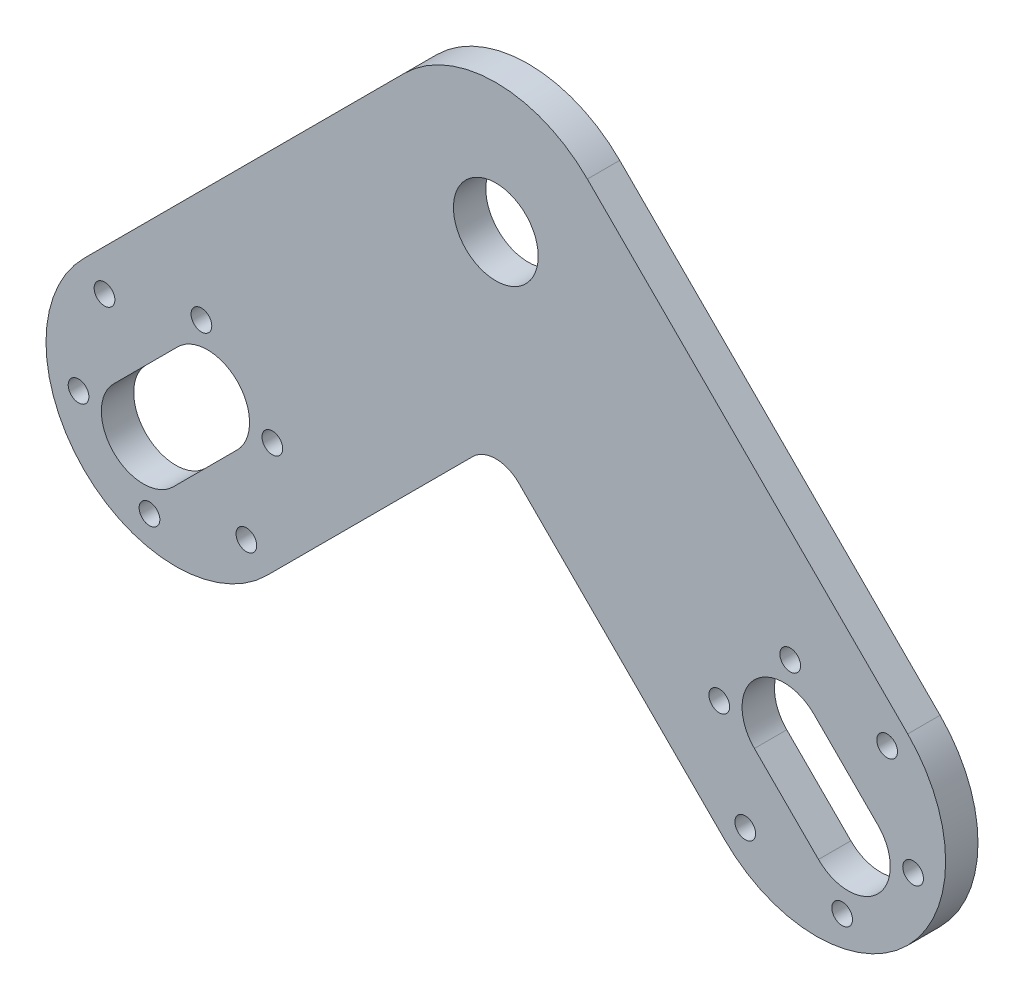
SolidWorks part; units mm, degrees
ref_plane "前视基准面" through (0, 0, 0) normal (0, 0, 1) x (1, 0, 0)
ref_plane "上视基准面" through (0, 0, 0) normal (0, 1, 0) x (1, 0, 0)
ref_plane "右视基准面" through (0, 0, 0) normal (1, 0, 0) x (0, 0, -1)
other "Configuration Table"
sketch "草图1" plane through (0, 0, 0) normal (0, 0, 1) x (1, 0, 0)
  line L0 (0, 0) -> (49.4975, 49.4975)
  line L1 (-14.1421, 14.1421) -> (35.3553, 63.6396)
  line L2 (14.1421, -14.1421) -> (49.4975, 21.2132)
  line L3 (49.4975, 49.4975) -> (49.4975, 29.4975) construction
  line L4 (84.8528, -14.1421) -> (49.4975, 21.2132)
  line L5 (113.1371, 14.1421) -> (63.6396, 63.6396)
  line L6 (98.9949, 0) -> (49.4975, 49.4975)
  line L7 (49.4975, 21.2132) -> (35.3553, 35.3553) construction
  line L8 (49.4975, 29.4975) -> (49.4975, 21.2132) construction
  line L9 (49.4975, 21.2132) -> (49.4975, -18.5446) construction
  line L10 (49.4975, 21.2132) -> (63.6396, 35.3553) construction
  circle A3 centre (0, 0) radius 20
  circle A4 centre (49.4975, 49.4975) radius 20
  circle A5 centre (98.9949, 0) radius 20
  dimension "D1" = 40
  dimension "D2" = 40
  dimension "D3" = 45
  dimension "D4" = 70
extrude "凸台-拉伸1" add sketch "草图1" along normal blind 5
fillet "圆角1" radius 5 1 edges at (49.4975, 21.2132, 2.5)
sketch "草图2" plane through (0, 0, 0) normal (0, 0, -1) x (-1, 0, 0)
  line L0 (-49.4975, 19.1421) -> (-49.4975, 0.3536)
  line L1 (-108.5409, -0.3536) -> (-98.6414, 9.5459)
  line L2 (-9.5459, 0.3536) -> (0.3536, -9.5459)
  line L3 (9.5459, -0.3536) -> (-0.3536, 9.5459)
  line L4 (-9.5459, 0.3536) -> (0.3536, -9.5459)
  line L5 (9.5459, -0.3536) -> (-0.3536, 9.5459)
  line L6 (-89.449, 0.3536) -> (-99.3485, -9.5459)
  arc A0 (13.8405, -5.1431) -> (16.1032, -2.8803) centre (14.9719, -4.0117) ccw construction
  arc A1 (16.1032, -2.8803) -> (13.8405, -5.1431) centre (14.9719, -4.0117) ccw construction
  arc A2 (9.8288, 9.8288) -> (12.0915, 12.0915) centre (10.9602, 10.9602) ccw
  arc A3 (12.0915, 12.0915) -> (9.8288, 9.8288) centre (10.9602, 10.9602) ccw
  arc A4 (9.8288, 9.8288) -> (12.0915, 12.0915) centre (10.9602, 10.9602) ccw
  arc A5 (12.0915, 12.0915) -> (9.8288, 9.8288) centre (10.9602, 10.9602) ccw
  arc A6 (-12.0915, -12.0915) -> (-9.8288, -9.8288) centre (-10.9602, -10.9602) ccw
  arc A7 (-9.8288, -9.8288) -> (-12.0915, -12.0915) centre (-10.9602, -10.9602) ccw
  arc A8 (-12.0915, -12.0915) -> (-9.8288, -9.8288) centre (-10.9602, -10.9602) ccw
  arc A9 (-9.8288, -9.8288) -> (-12.0915, -12.0915) centre (-10.9602, -10.9602) ccw
  arc A10 (-16.1032, 2.8803) -> (-13.8405, 5.1431) centre (-14.9719, 4.0117) ccw
  arc A11 (-13.8405, 5.1431) -> (-16.1032, 2.8803) centre (-14.9719, 4.0117) ccw
  arc A12 (-16.1032, 2.8803) -> (-13.8405, 5.1431) centre (-14.9719, 4.0117) ccw
  arc A13 (-13.8405, 5.1431) -> (-16.1032, 2.8803) centre (-14.9719, 4.0117) ccw
  arc A14 (-5.1431, 13.8405) -> (-2.8803, 16.1032) centre (-4.0117, 14.9719) ccw
  arc A15 (-2.8803, 16.1032) -> (-5.1431, 13.8405) centre (-4.0117, 14.9719) ccw
  arc A16 (-5.1431, 13.8405) -> (-2.8803, 16.1032) centre (-4.0117, 14.9719) ccw
  arc A17 (-2.8803, 16.1032) -> (-5.1431, 13.8405) centre (-4.0117, 14.9719) ccw
  arc A18 (2.8803, -16.1032) -> (5.1431, -13.8405) centre (4.0117, -14.9719) ccw
  arc A19 (5.1431, -13.8405) -> (2.8803, -16.1032) centre (4.0117, -14.9719) ccw
  arc A20 (2.8803, -16.1032) -> (5.1431, -13.8405) centre (4.0117, -14.9719) ccw
  arc A21 (5.1431, -13.8405) -> (2.8803, -16.1032) centre (4.0117, -14.9719) ccw
  arc A22 (0.3536, -9.5459) -> (9.5459, -0.3536) centre (4.9497, -4.9497) ccw
  arc A23 (-0.3536, 9.5459) -> (-9.5459, 0.3536) centre (-4.9497, 4.9497) ccw
  arc A24 (0.3536, -9.5459) -> (9.5459, -0.3536) centre (4.9497, -4.9497) ccw
  arc A25 (-0.3536, 9.5459) -> (-9.5459, 0.3536) centre (-4.9497, 4.9497) ccw
  arc A26 (13.8405, -5.1431) -> (16.1032, -2.8803) centre (14.9719, -4.0117) ccw
  arc A27 (16.1032, -2.8803) -> (13.8405, -5.1431) centre (14.9719, -4.0117) ccw
  arc A28 (-45.9619, 17.6777) -> (-53.033, 17.6777) centre (-49.4975, 14.1421) ccw construction
  arc A29 (-101.8753, -16.1032) -> (-104.138, -13.8405) centre (-103.0066, -14.9719) cw
  arc A30 (-115.0982, -2.8803) -> (-112.8354, -5.1431) centre (-113.9668, -4.0117) cw
  arc A31 (-112.8354, -5.1431) -> (-115.0982, -2.8803) centre (-113.9668, -4.0117) cw
  arc A32 (-98.6414, 9.5459) -> (-89.449, 0.3536) centre (-94.0452, 4.9497) cw
  arc A33 (-99.3485, -9.5459) -> (-108.5409, -0.3536) centre (-103.9447, -4.9497) cw
  arc A34 (-104.138, -13.8405) -> (-101.8753, -16.1032) centre (-103.0066, -14.9719) cw
  arc A35 (-96.1146, 16.1032) -> (-93.8519, 13.8405) centre (-94.9833, 14.9719) cw
  arc A36 (-93.8519, 13.8405) -> (-96.1146, 16.1032) centre (-94.9833, 14.9719) cw
  arc A37 (-85.1545, 5.1431) -> (-82.8917, 2.8803) centre (-84.0231, 4.0117) cw
  arc A38 (-82.8917, 2.8803) -> (-85.1545, 5.1431) centre (-84.0231, 4.0117) cw
  arc A39 (-89.1662, -9.8288) -> (-86.9034, -12.0915) centre (-88.0348, -10.9602) cw
  arc A40 (-86.9034, -12.0915) -> (-89.1662, -9.8288) centre (-88.0348, -10.9602) cw
  arc A41 (-111.0865, 12.0915) -> (-108.8237, 9.8288) centre (-109.9551, 10.9602) cw
  arc A42 (-108.8237, 9.8288) -> (-111.0865, 12.0915) centre (-109.9551, 10.9602) cw
  dimension "D1" = 0
  dimension "D2" = 0
  dimension "D3" = 0
  dimension "D4" = 0
  dimension "D5" = 0
  dimension "D6" = 0
extrude "切除-拉伸1" cut sketch "草图2" against normal blind 10 contours A33 L6 A32 L1 | A36 A35 | A42 A41 | A31 A30 | A38 A37 | A40 A39 | A34 A29 | A12 A13 | L5 A25 L4 A24 | A16 A17 | A4 A5 | A26 A27 | A20 A21 | A8 A9
sketch "草图3" plane through (0, 0, 5) normal (0, 0, 1) x (1, 0, 0)
  arc A0 (63.6396, 63.6396) -> (35.3553, 63.6396) centre (49.4975, 49.4975) ccw construction
  arc A1 (63.6396, 63.6396) -> (35.3553, 63.6396) centre (49.4975, 49.4975) ccw
  circle A2 centre (49.4975, 49.4975) radius 6.55
  dimension "D1" = 13.1
extrude "切除-拉伸2" cut sketch "草图3" against normal blind 6 contours A2
